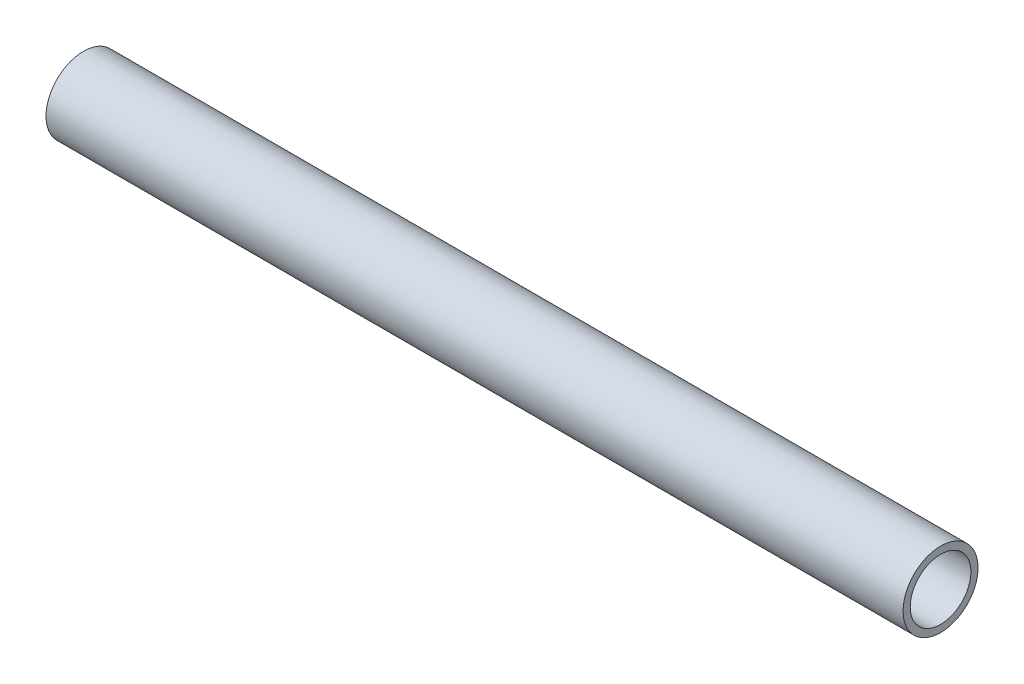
SolidWorks part; units mm, degrees
ref_plane "Plan de face" through (0, 0, 0) normal (0, 0, 1) x (1, 0, 0)
ref_plane "Plan de dessus" through (0, 0, 0) normal (0, 1, 0) x (1, 0, 0)
ref_plane "Plan de droite" through (0, 0, 0) normal (1, 0, 0) x (0, 0, -1)
sketch "Esquisse1" plane through (0, 0, 0) normal (0, 0, 1) x (1, 0, 0)
  line L0 (-62.1158, 0) -> (55.8431, 0) construction
  line L1 (-120, 10.5) -> (120, 10.5)
  line L2 (-120, 10.5) -> (-120, 8.5)
  line L3 (-120, 8.5) -> (120, 8.5)
  line L4 (120, 10.5) -> (120, 8.5)
  line L6 (0, 8.5) -> (0, 0) construction
  dimension "D1" = 21
  dimension "D2" = 2
  dimension "D3" = 240
revolve "Révolution1" add sketch "Esquisse1" angle 360 about L0
ref_point "Point1"
ref_point "Point2"
